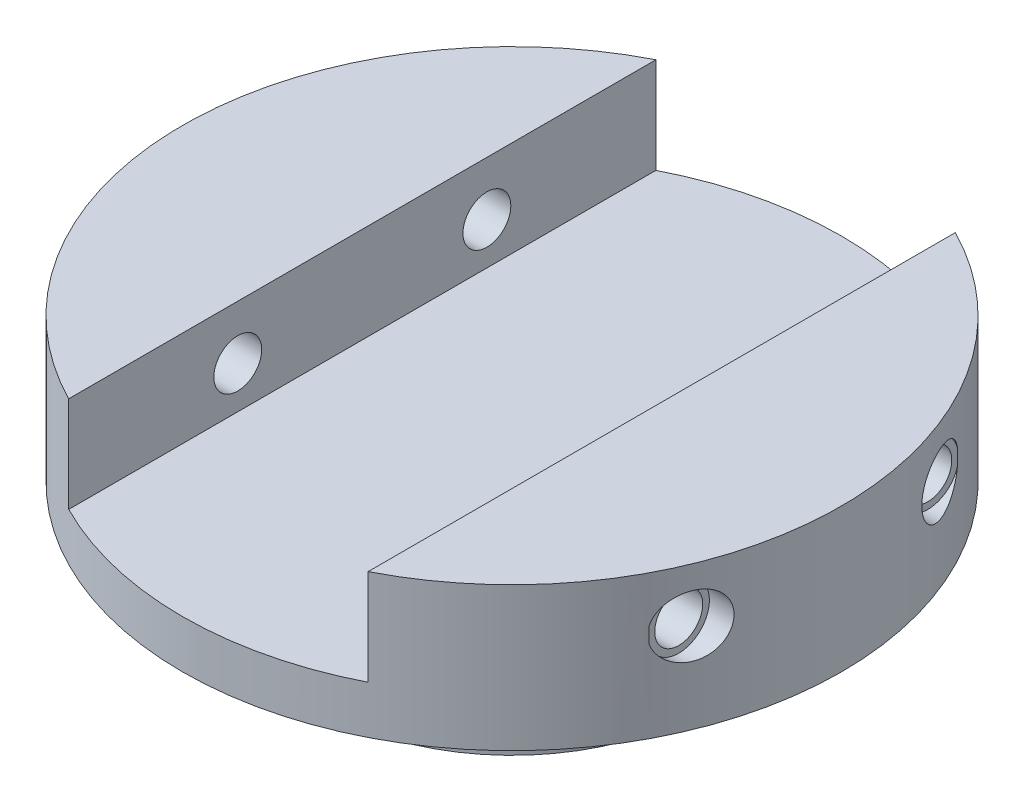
SolidWorks part; units mm, degrees
ref_plane "Front" through (0, 0, 0) normal (0, 0, 1) x (1, 0, 0)
ref_plane "Top" through (0, 0, 0) normal (0, 1, 0) x (1, 0, 0)
ref_plane "Right" through (0, 0, 0) normal (1, 0, 0) x (0, 0, -1)
sketch "Sketch1" plane through (0, 0, 0) normal (0, 1, 0) x (1, 0, 0)
  circle A0 centre (0, 0) radius 43.688
  dimension "D1" = 87.376
extrude "Extrude1" add sketch "Sketch1" along normal blind 19.05
sketch "Sketch2" plane through (0, 0, 0) normal (1, 0, 0) x (0, 0, -1)
  line L1 (-43.688, 19.05) -> (43.688, 19.05)
  line L2 (-43.688, 19.05) -> (-43.688, 6.35)
  line L3 (-43.688, 6.35) -> (43.688, 6.35)
  line L4 (43.688, 19.05) -> (43.688, 6.35)
  line L5 (43.688, 0) -> (43.688, 19.05) construction
  line L6 (-43.688, 19.05) -> (-43.688, 0) construction
  line L7 (43.688, 19.05) -> (-43.688, 19.05) construction
  dimension "D1" = 12.7
extrude "Cut-Extrude1" cut sketch "Sketch2" against normal mid plane 39.6875
sketch "Sketch3" plane through (0, 0, 0) normal (0, 0, 1) x (1, 0, 0)
  line L0 (0, 8.9402) -> (0, -14.326) construction
  line L2 (-43.688, 0) -> (43.688, 0) construction
  line L3 (25.3746, 0) -> (25.3746, -2.3876)
  line L4 (25.3746, -2.3876) -> (22.8669, -2.3876)
  line L5 (21.4811, -4.7879) -> (25.3746, -11.5316)
  line L6 (25.3746, -13.4874) -> (0, -13.4874)
  line L7 (0, -13.4874) -> (0, 0)
  line L8 (25.3746, 0) -> (0, 0)
  line L9 (25.3746, -11.5316) -> (25.3746, -13.4874)
  arc A0 (22.8669, -2.3876) -> (21.4811, -4.7879) centre (22.8669, -3.9878) ccw
  dimension "D6" = 1.6002
  dimension "D1" = 50.7492
  dimension "D2" = 2.3876
  dimension "D3" = 120
  dimension "D4" = 9.144
  dimension "D5" = 13.4874
revolve "Revolve1" add sketch "Sketch3" angle 360 about L0
ref_plane "Plane1" through (0, 0, 16.51) normal (0, 0, 1) x (1, 0, 0)
sketch "Sketch4" plane through (0, 0, 16.51) normal (0, 0, 1) x (1, 0, 0)
  line L0 (-48.9087, 11.9126) -> (56.9735, 11.9126) construction
  line L1 (43.688, 19.05) -> (19.8438, 19.05) construction
  line L2 (43.688, 11.9126) -> (43.688, 7.8486)
  line L3 (43.688, 7.8486) -> (38.608, 7.8486)
  line L4 (38.608, 7.8486) -> (38.608, 8.7376)
  line L5 (38.608, 8.7376) -> (16.7032, 8.7376)
  line L6 (16.7032, 8.7376) -> (16.7032, 11.9126)
  line L7 (16.7032, 11.9126) -> (43.688, 11.9126)
  line L8 (43.688, 0) -> (43.688, 19.05) construction
  dimension "D1" = 7.1374
  dimension "D2" = 8.128
  dimension "D3" = 6.35
  dimension "D4" = 5.08
revolve "Cut-Revolve1" cut sketch "Sketch4" angle 360 about L0
mirror "Mirror1" about plane through (0, 0, 0) normal (0, 0, 1)
mirror "Mirror2" about plane through (0, 0, 0) normal (1, 0, 0)
